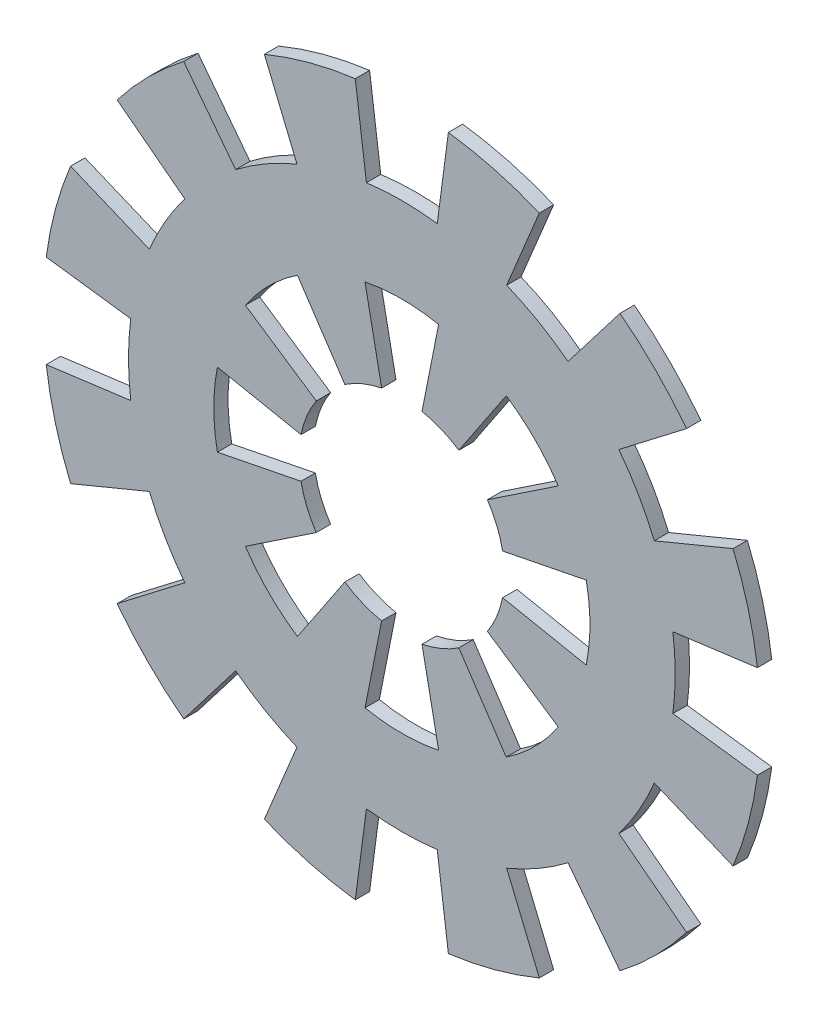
SolidWorks part; units mm, degrees
ref_plane "Front Plane" through (0, 0, 0) normal (0, 0, 1) x (1, 0, 0)
ref_plane "Top Plane" through (0, 0, 0) normal (0, 1, 0) x (1, 0, 0)
ref_plane "Right Plane" through (0, 0, 0) normal (1, 0, 0) x (0, 0, -1)
sketch "BodySke" plane through (0, 0, 0) normal (0, 1, 0) x (1, 0, 0)
  line L0 (0, 0) -> (0, 8) construction
  line L1 (0, 0) -> (-12, 0) construction
  line L2 (2.15, 0) -> (7.5, 0)
  line L3 (2.15, 0) -> (2.15, 0.3)
  line L4 (2.15, 0.3) -> (7.5, 0.3)
  line L5 (7.5, 0) -> (7.5, 0.3)
  dimension "Inner_dia" = 4.3
  dimension "Outer_dia" = 15
  dimension "Thickness" = 0.3
  dimension "Num_inpat" = 8
  dimension "Num_expat" = 12
revolve "BaseBody" add sketch "BodySke" angle 360 about L0
sketch "ToothInSke" plane through (0, 0, 0) normal (0, 0, 1) x (1, 0, 0)
  line L0 (0, 0) -> (0, 2.7341) construction
  line L2 (-0.7701, 3.8572) -> (-0.4222, 2.1081)
  line L3 (-0.4222, 2.1081) -> (0.4222, 2.1081)
  line L4 (0.7701, 3.8572) -> (0.4222, 2.1081)
  arc A0 (0.7701, 3.8572) -> (-0.7701, 3.8572) centre (0, 0) ccw construction
  arc A1 (-3.9333, 0) -> (3.9333, 0) centre (0, 0) ccw construction
  circle A2 centre (0, 0) radius 2.15 construction
  circle A3 centre (0, 0) radius 2.15 construction
  arc A4 (0.7701, 3.8572) -> (-0.7701, 3.8572) centre (0, 0) ccw
  point P11 (0, 2.1081)
  point P12 (0, 3.9333)
  dimension "D1" = 7.8667
  dimension "D2" = 0.8443
  dimension "D3" = 22.5
extrude "ToothCutIn" cut sketch "ToothInSke" against normal through all
pattern_circular "ToothInPat" count 8 over 360 about axis through (0, 0, 0) along (0, 0, 1) of "ToothCutIn"
sketch "ToothExSke" plane through (0, 0, 0) normal (0, 0, 1) x (1, 0, 0)
  line L0 (0, 0) -> (8.6397, 0) construction
  line L1 (7.5, -0.9817) -> (7.5, 0.9817)
  line L2 (7.5, 0.9817) -> (5.6685, 0.7406)
  line L3 (7.5, -0.9817) -> (5.6685, -0.7406)
  arc A0 (-5.7167, 0) -> (5.6685, 0.7406) centre (0, 0) ccw construction
  circle A1 centre (0, 0) radius 7.5 construction
  circle A2 centre (0, 0) radius 7.5 construction
  arc A3 (5.6685, -0.7406) -> (5.6685, 0.7406) centre (0, 0) ccw
  point P11 (7.5, 0)
  dimension "D1" = 11.4333
  dimension "D2" = 1.9635
  dimension "D3" = 15
extrude "ToothCutEx" cut sketch "ToothExSke" against normal through all
pattern_circular "ToothExPat" count 12 over 360 about axis through (0, 0, 0) along (0, 0, 1) of "ToothCutEx"
equation "\"D1@ToothInSke\" =  \"Inner_dia@BodySke\" +  ( \"Outer_dia@BodySke\" - \"Inner_dia@BodySke\" )  / 3"
equation "\"D2@ToothInSke\" =  pi  * \"Inner_dia@BodySke\" / 2 / \"Num_inpat@BodySke\""
equation "\"D3@ToothInSke\" = 180 / \"Num_inpat@BodySke\""
equation "\"Num_inpat@ToothInPat\" = \"Num_inpat@BodySke\""
equation "\"D1@ToothExSke\" = \"Inner_dia@BodySke\" +  ( \"Outer_dia@BodySke\" - \"Inner_dia@BodySke\" )  * 2 / 3"
equation "\"D2@ToothExSke\" = pi  * \"Outer_dia@BodySke\" / 2 / \"Num_expat@BodySke\""
equation "\"D3@ToothExSke\" = 180 / \"Num_expat@BodySke\""
equation "\"Num_expat@ToothExPat\" = \"Num_expat@BodySke\""
